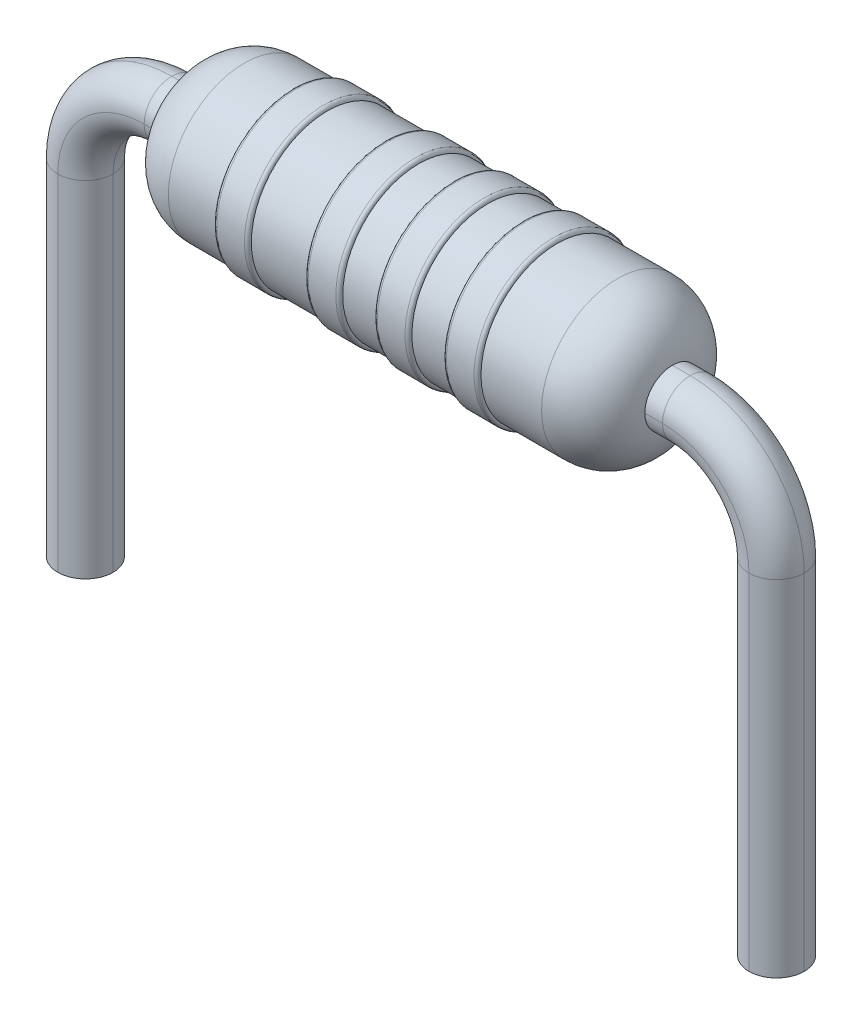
SolidWorks part; units mm, degrees
ref_plane "Face" through (0, 0, 0) normal (0, 0, 1) x (1, 0, 0)
ref_plane "Dessus" through (0, 0, 0) normal (0, 1, 0) x (1, 0, 0)
ref_plane "Droite" through (0, 0, 0) normal (1, 0, 0) x (0, 0, -1)
sketch "Esquisse1" plane through (0, 0, 0) normal (0, 0, 1) x (1, 0, 0)
  line L0 (-54.2687, 0) -> (62.1733, 0) construction
  line L1 (-48.4922, 1.1) -> (45.7559, 1.1) construction
  line L2 (-3.5, -1.6411) -> (-3.5, 4.3175) construction
  line L3 (0, -1.0268) -> (0, 4.1947) construction
  line L4 (3.5, 3.6009) -> (3.5, -1.9687) construction
  line L5 (-3.5, 0) -> (-3.5, 0.3)
  line L6 (-2.7, 1.1) -> (2.7, 1.1)
  line L7 (3.5, 0.3) -> (3.5, 0)
  line L8 (3.5, 0) -> (-3.5, 0)
  arc A0 (-2.7, 1.1) -> (-3.5, 0.3) centre (-2.7, 0.3) ccw
  arc A1 (3.5, 0.3) -> (2.7, 1.1) centre (2.7, 0.3) ccw
revolve "Base-Révolution" add sketch "Esquisse1" angle 360 about L0
sketch "Esquisse2" plane through (0, 0, 0) normal (0, 0, 1) x (1, 0, 0)
  line L0 (-3.3896, 1.15) -> (3.161, 1.15) construction
  line L1 (-2, 1.3889) -> (-2, -0.1179) construction
  line L2 (-1.5, 1.4925) -> (-1.5, -0.2136) construction
  line L3 (4.3262, 0) -> (-3.8651, 0) construction
  line L4 (1.323, 0) -> (1.823, 0)
  line L5 (0.323, 0) -> (0.823, 0)
  line L6 (-0.677, 1.15) -> (-0.677, 0)
  line L7 (0.323, 1.15) -> (0.323, 0)
  line L8 (1.323, 1.15) -> (1.323, 0)
  line L9 (-0.177, 1.15) -> (-0.177, 0)
  line L10 (0.823, 1.15) -> (0.823, 0)
  line L11 (1.823, 1.15) -> (1.823, 0)
  line L12 (-0.677, 0) -> (-0.177, 0)
  line L13 (-0.677, 1.15) -> (-0.177, 1.15)
  line L14 (0.323, 1.15) -> (0.823, 1.15)
  line L15 (1.323, 1.15) -> (1.823, 1.15)
  line L16 (-2, 1.15) -> (-1.5, 1.15)
  line L17 (-1.5, 1.15) -> (-1.5, 0)
  line L18 (-1.5, 0) -> (-2, 0)
  line L19 (-2, 0) -> (-2, 1.15)
revolve "Boss.-Révol.1" add sketch "Esquisse2" angle 360 about L3
fillet "Congé1" radius 0.05 8 edges at (-0.177, 0, -1.15) (-0.677, 0, -1.15) (0.823, 0, -1.15) (0.323, 0, -1.15) (1.823, 0, -1.15) (1.323, 0, -1.15) (-1.5, 0, -1.15) (-2, 0, -1.15)
sketch "Esquisse4" plane through (0, 0, 0) normal (0, 0, 1) x (1, 0, 0)
  line L0 (-5.2315, 0) -> (5.4216, 0) construction
  line L1 (-5, 1.8916) -> (-5, -12.2251) construction
  line L2 (5, 2.0093) -> (5, -12.4289) construction
  line L3 (6.4645, -1.2406) -> (-6.3169, -1.2406) construction
  line L4 (-3.75, 0.4094) -> (3.75, 0.4094)
  line L5 (0, 2.2206) -> (0, -4.4447) construction
  line L6 (5.4, -1.2406) -> (5.4, -6.2319)
  line L7 (5.4, -6.2319) -> (4.6, -6.2319)
  line L8 (-5.4, -1.2406) -> (-5.4, -6.2319)
  line L9 (-5.4, -6.2319) -> (-4.6, -6.2319)
  line L10 (3.75, -0.3906) -> (-3.75, -0.3906)
  line L11 (4.6, -6.2319) -> (4.6, -1.2406)
  line L12 (-4.6, -6.2319) -> (-4.6, -1.2406)
  line L13 (-3.75, 0.4094) -> (-3.75, -1.7804) construction
  line L14 (3.75, 2.0093) -> (3.75, -1.7804) construction
  arc A0 (-3.75, 0.4094) -> (-5.4, -1.2406) centre (-3.75, -1.2406) ccw
  arc A1 (3.75, 0.4094) -> (5.4, -1.2406) centre (3.75, -1.2406) cw
  arc A4 (-4.6, -1.2406) -> (-3.75, -0.3906) centre (-3.75, -1.2406) cw
  arc A5 (3.75, -0.3906) -> (4.6, -1.2406) centre (3.75, -1.2406) cw
  dimension "D1" = 7.5
  dimension "D2" = 0.8
  dimension "D4" = 0.8
extrude "Boss.-Extru.1" add sketch "Esquisse4" along normal mid plane 0.8
fillet "Congé7" radius 0.4 48 edges at (-1.916, 0.2251, -0.4) (-1.9404, -0.3906, 0.3884) (-1.9125, 0.4094, 0.1632) (-1.916, 0.2251, 0.4) (3.6011, 0.4094, -0.4) (1.9125, 0.4094, -0.1632) (3.75, 0.4094, 0) (-3.6011, 0.4094, -0.4) (1.9404, -0.3906, -0.3884) (3.6034, -0.3906, -0.4) (-3.6034, -0.3906, -0.4) (-3.75, -0.3906, 0) (3.6011, 0.4094, 0.4) (1.9175, -0.2399, 0.4) (3.6034, -0.3906, 0.4) (4.351, -0.6396, 0.4) (4.6, -3.7363, 0.4) (5, -6.2319, 0.4) (5.4, -3.7363, 0.4) (4.9167, -0.0739, 0.4) (-3.6034, -0.3906, 0.4) (-3.6011, 0.4094, 0.4) (-4.9167, -0.0739, 0.4) (-5.4, -3.7363, 0.4) (-5, -6.2319, 0.4) (-4.6, -3.7363, 0.4) (-4.351, -0.6396, 0.4) (4.9167, -0.0739, -0.4) (5.4, -1.2406, 0) (-4.9167, -0.0739, -0.4) (-3.75, 0.4094, 0) (-5.4, -3.7363, -0.4) (-5.4, -1.2406, 0) (-5, -6.2319, -0.4) (-5.4, -6.2319, 0) (-4.6, -3.7363, -0.4) (-4.6, -6.2319, 0) (-4.351, -0.6396, -0.4) (-4.6, -1.2406, 0) (4.351, -0.6396, -0.4) (3.75, -0.3906, 0) (4.6, -3.7363, -0.4) (4.6, -1.2406, 0) (5, -6.2319, -0.4) (4.6, -6.2319, 0) (5.4, -3.7363, -0.4) (5.4, -6.2319, 0) (1.9175, -0.2399, -0.4)
